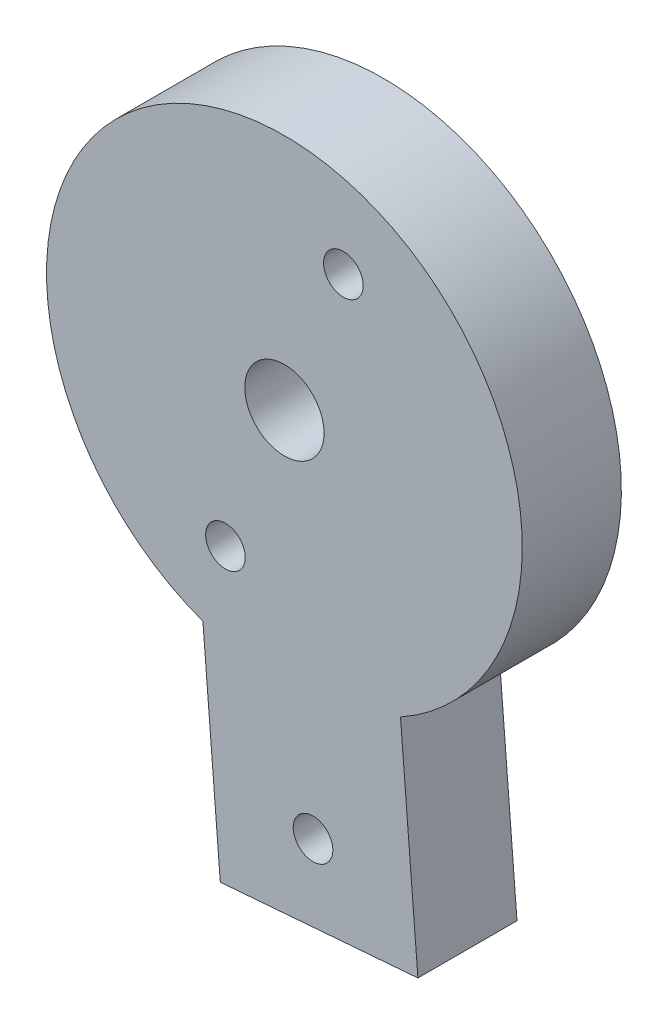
SolidWorks part; units mm, degrees
ref_plane "Front Plane" through (0, 0, 0) normal (0, 0, 1) x (1, 0, 0)
ref_plane "Top Plane" through (0, 0, 0) normal (0, 1, 0) x (1, 0, 0)
ref_plane "Right Plane" through (0, 0, 0) normal (1, 0, 0) x (0, 0, -1)
sketch "Sketch1" plane through (0, 0, 0) normal (0, 0, 1) x (1, 0, 0)
  line L0 (5.016, 0) -> (10.5643, 0) construction
  line L1 (0, 0) -> (0.7612, -9.4966) construction
  line L3 (-4.1124, -11.2733) -> (-3.2334, -22.2382)
  line L4 (-3.2334, -22.2382) -> (6.7346, -21.4391)
  line L5 (6.7346, -21.4391) -> (5.8557, -10.4743)
  arc A0 (5.8557, -10.4743) -> (-4.1124, -11.2733) centre (0, 0) ccw
  dimension "D1" = 274.583
  dimension "D2" = 11
  dimension "D6" = 90
extrude "Boss-Extrude1" add sketch "Sketch1" along normal blind 5
sketch "Sketch2" plane through (0, 0, 5) normal (0, 0, 1) x (1, 0, 0)
  line L0 (0, 0) -> (1.7506, -21.8387) construction
  line L1 (-3.2334, -22.2382) -> (6.7346, -21.4391) construction
  circle A0 centre (0, 0) radius 2
  circle A1 centre (1.4431, -18.0032) radius 1
  dimension "D1" = 18.0609
extrude "Cut-Extrude1" cut sketch "Sketch2" against normal blind 5
sketch "Sketch3" plane through (0, 0, 5) normal (0, 0, 1) x (1, 0, 0)
  line L0 (0, 0) -> (10.4161, 0) construction
  line L1 (0, 0) -> (3.3461, 8.3531) construction
  line L2 (0, 0) -> (-2.8293, -7.0631) construction
  circle A0 centre (2.9748, 7.4263) radius 1
  circle A1 centre (-2.9748, -7.4263) radius 1
  circle A2 centre (0, 0) radius 2 construction
  dimension "D3" = 8
  dimension "D4" = 8
  dimension "D1" = 68.17
  dimension "D2" = 180
extrude "Cut-Extrude2" cut sketch "Sketch3" against normal blind 5
sketch "Sketch4" plane through (0, 0, 5) normal (0, 0, 1) x (1, 0, 0)
  line L0 (0, 0) -> (9.8237, 0)
